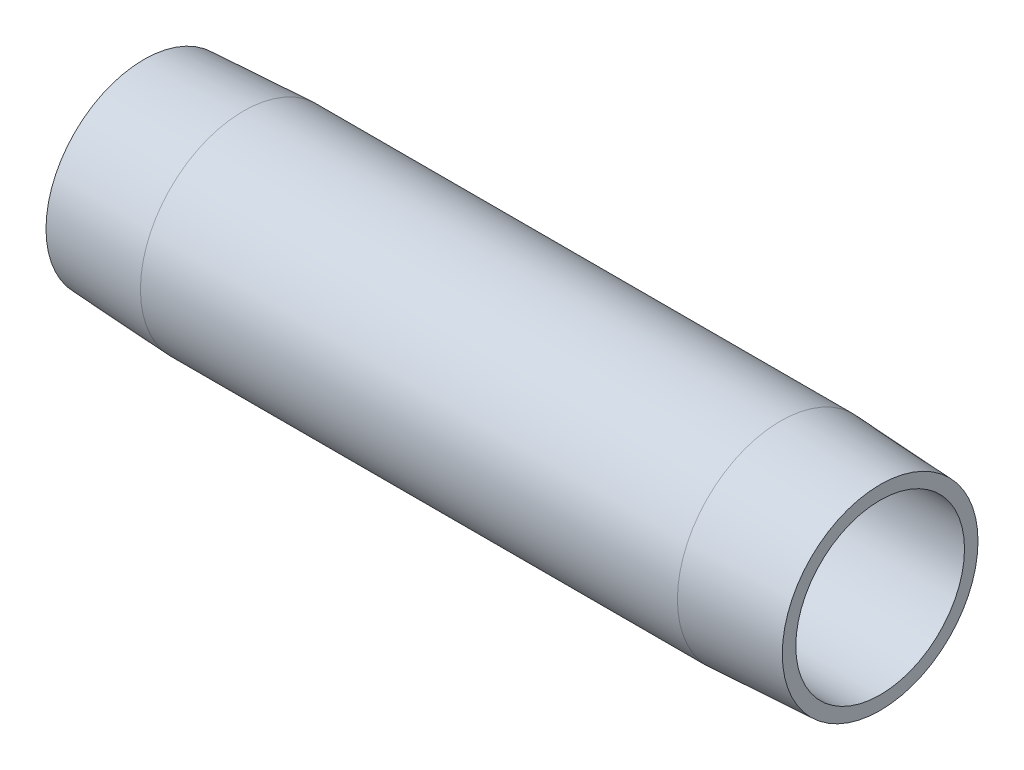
SolidWorks part; units mm, degrees
ref_plane "Front Plane" through (0, 0, 0) normal (0, 0, 1) x (1, 0, 0)
ref_plane "Top Plane" through (0, 0, 0) normal (0, 1, 0) x (1, 0, 0)
ref_plane "Right Plane" through (0, 0, 0) normal (1, 0, 0) x (0, 0, -1)
sketch "Sketch1" plane through (0, 0, 0) normal (0, 0, 1) x (1, 0, 0)
  line L6 (76.2, 8.7313) -> (0, 8.7313)
  line L7 (10.3124, 10.668) -> (0, 10.1276)
  line L8 (65.8876, 10.668) -> (10.3124, 10.668)
  line L9 (76.2, 10.1276) -> (65.8876, 10.668)
  line L10 (76.2, 8.7313) -> (76.2, 10.1276)
  line L11 (0, 10.1276) -> (0, 8.7313)
  line L12 (0, 0) -> (50000, 0) construction
  line L13 (0, -55) -> (0, 55) construction
  dimension "D1" = 76.2
  dimension "D2" = 3
  dimension "D3" = 3
  dimension "D4" = 21.336
  dimension "D5" = 17.4625
  dimension "D6" = 10.3124
  dimension "D7" = 10.3124
revolve "Revolve1" add sketch "Sketch1" angle 360 about L12
